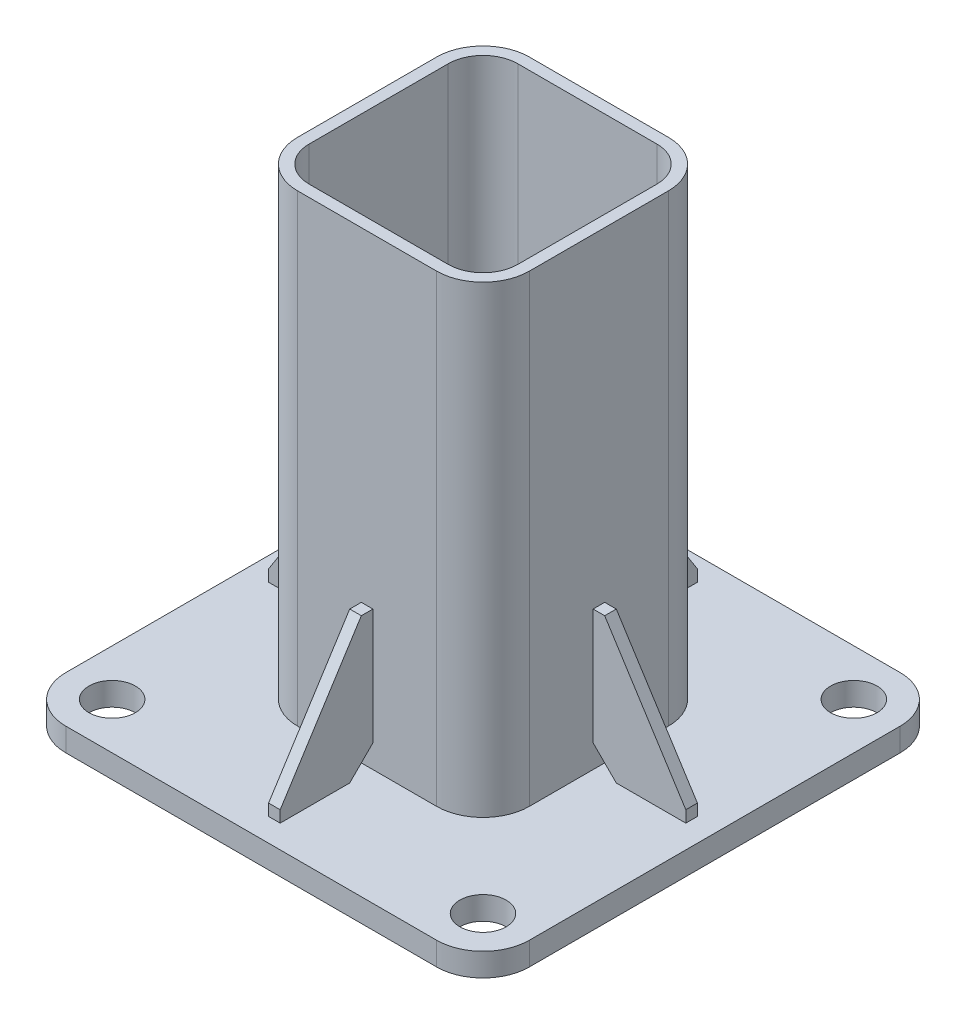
SolidWorks part; units mm, degrees
other "DetailItem3"
other "Weld Folder"
other "Weld Bead3"
ref_plane "Front Plane" through (0, 0, 0) normal (0, 0, 1) x (1, 0, 0)
ref_plane "Top Plane" through (0, 0, 0) normal (0, 1, 0) x (1, 0, 0)
ref_plane "Right Plane" through (0, 0, 0) normal (1, 0, 0) x (0, 0, -1)
sketch "Sketch1" plane through (0, 0, 0) normal (0, 1, 0) x (1, 0, 0)
  line L0 (0, 0) -> (0, 100) construction
  line L1 (-80, 100) -> (80, 100)
  line L2 (-100, 80) -> (-100, -80)
  line L3 (-80, -100) -> (80, -100)
  line L4 (100, 80) -> (100, -80)
  line L5 (-100, 100) -> (100, -100) construction
  line L6 (-100, -100) -> (100, 100) construction
  line L7 (0, 0) -> (100, 0) construction
  arc A0 (-80, 100) -> (-100, 80) centre (-80, 80) ccw
  arc A1 (80, 100) -> (100, 80) centre (80, 80) cw
  arc A2 (80, -100) -> (100, -80) centre (80, -80) ccw
  arc A3 (-100, -80) -> (-80, -100) centre (-80, -80) ccw
  circle A4 centre (80, 80) radius 10
  circle A5 centre (-80, 80) radius 10
  circle A6 centre (80, -80) radius 10
  circle A7 centre (-80, -80) radius 10
  point P0 (0, 0)
  dimension "D2" = 20
  dimension "D3" = 20
  dimension "D1" = 200
extrude "Boss-Extrude1" add sketch "Sketch1" along normal blind 10
sketch "Sketch2" plane through (0, 10, 0) normal (0, 1, 0) x (1, 0, 0)
  line L1 (-30, 50) -> (30, 50)
  line L2 (-50, 30) -> (-50, -30)
  line L3 (-30, -50) -> (30, -50)
  line L4 (50, 30) -> (50, -30)
  line L5 (-50, 50) -> (50, -50) construction
  line L6 (-50, -50) -> (50, 50) construction
  arc A0 (-30, 50) -> (-50, 30) centre (-30, 30) ccw
  arc A1 (30, 50) -> (50, 30) centre (30, 30) cw
  arc A2 (-50, -30) -> (-30, -50) centre (-30, -30) ccw
  arc A3 (30, -50) -> (50, -30) centre (30, -30) ccw
  point P0 (0, 0)
  dimension "D1" = 100
  dimension "D2" = 20
extrude "Extrude-Thin1" add sketch "Sketch2" along normal blind 200 separate body thin
other "Gusset2" parameters "D1"=5, "D2"=5, "D3"=0, "D4"=0, "D10"=5, "D11"=60, "D12"=40, "D13"=5, "D14"=57.529, "D15"=5, "D16"=10, "D17"=10, "D18"=45
sketch "Sketch5" plane through (0, 10, 50) normal (1, 0, 0) x (0, 0, -1)
  line L0 (0, 10) -> (0, 60)
  line L1 (-10, 0) -> (-40, 0)
  line L2 (0, 10) -> (-10, 0)
  line L3 (-5, 60) -> (-40, 5)
  line L4 (0, 60) -> (-5, 60)
  line L5 (-40, 0) -> (-40, 5)
sketch "Sketch6" plane through (0, 0, 0) normal (1, 0, 0) x (0, 0, -1)
  line L0 (0, 0) -> (0, 210.2606) construction
pattern_circular "CirPattern1" count 4 over 360 about axis through (0, 0, 0) along (0, 1, 0)
